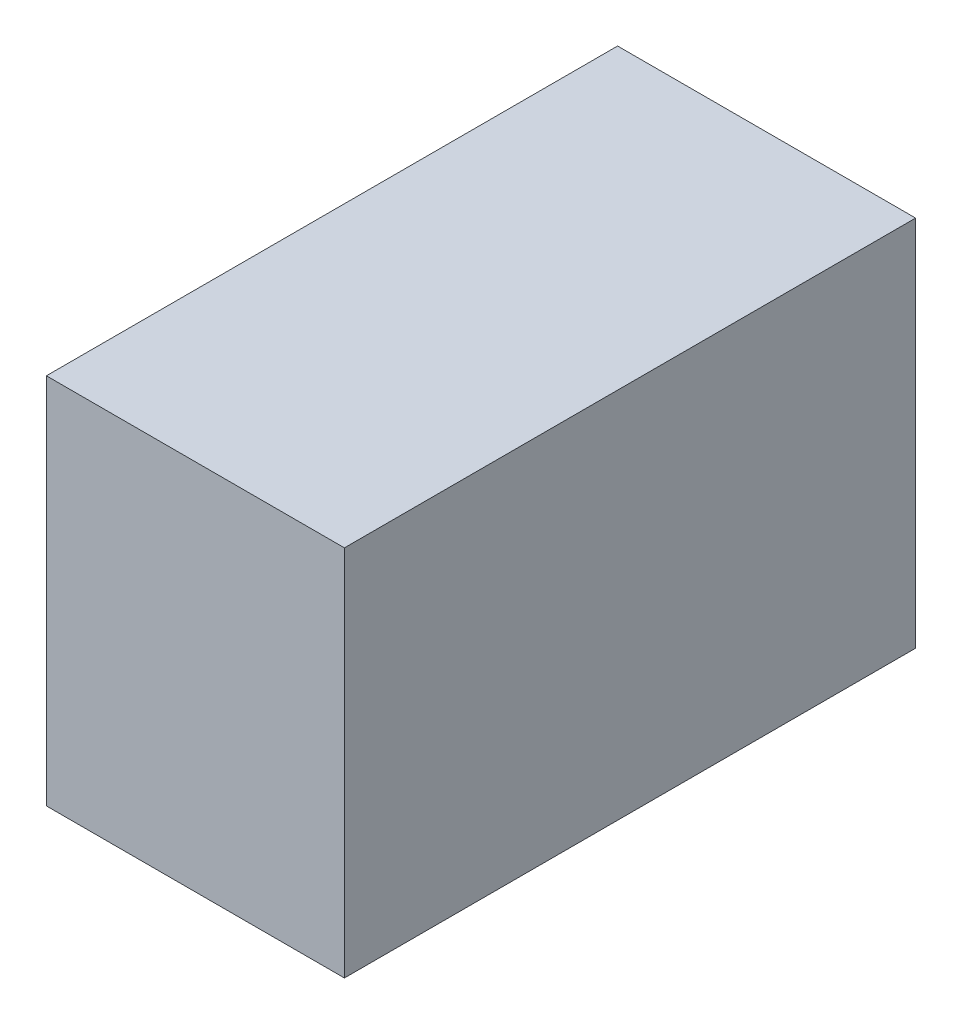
SolidWorks part; units mm, degrees
ref_plane "Front Plane" through (0, 0, 0) normal (0, 0, 1) x (1, 0, 0)
ref_plane "Top Plane" through (0, 0, 0) normal (0, 1, 0) x (1, 0, 0)
ref_plane "Right Plane" through (0, 0, 0) normal (1, 0, 0) x (0, 0, -1)
sketch "Sketch1" plane through (0, 0, 0) normal (0, 1, 0) x (1, 0, 0)
  line L1 (-30, 57.5) -> (30, 57.5)
  line L2 (-30, 57.5) -> (-30, -57.5)
  line L3 (-30, -57.5) -> (30, -57.5)
  line L4 (30, 57.5) -> (30, -57.5)
  line L5 (-30, 57.5) -> (30, -57.5) construction
  line L6 (-30, -57.5) -> (30, 57.5) construction
  point P0 (0, 0)
  dimension "D1" = 60
  dimension "D2" = 115
extrude "Boss-Extrude1" add sketch "Sketch1" along normal mid plane 75
